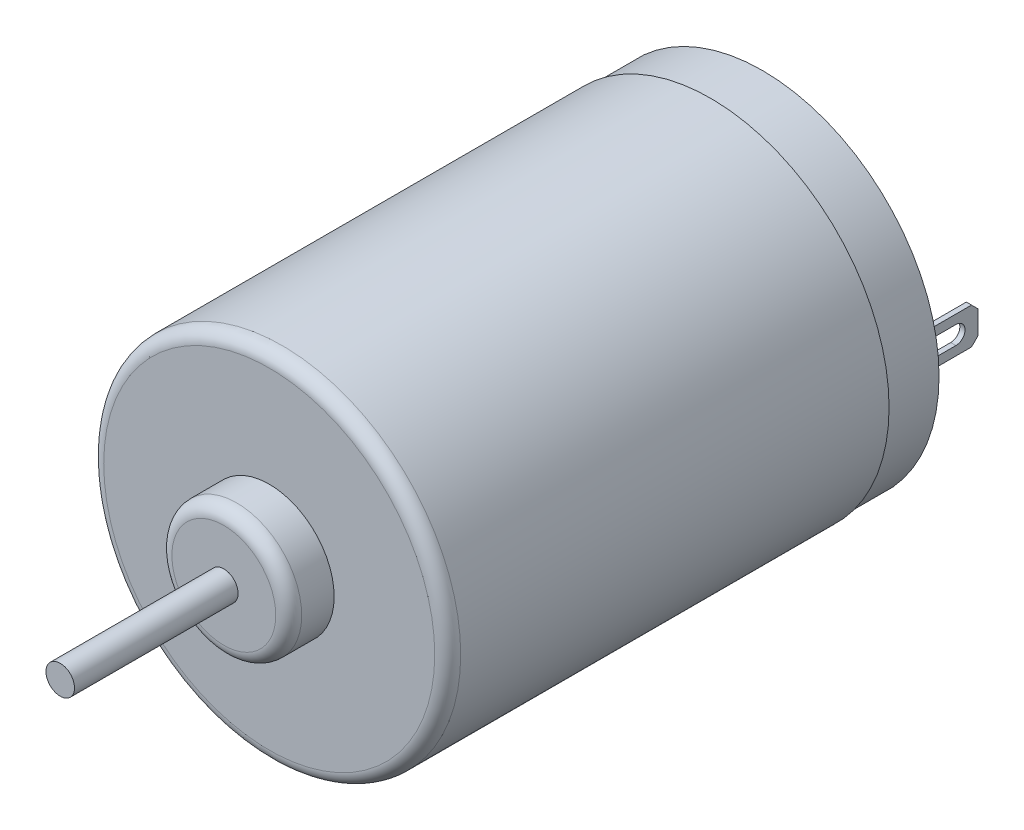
SolidWorks part; units mm, degrees
ref_plane "Plan de face" through (0, 0, 0) normal (0, 0, 1) x (1, 0, 0)
ref_plane "Plan de dessus" through (0, 0, 0) normal (0, 1, 0) x (1, 0, 0)
ref_plane "Plan de droite" through (0, 0, 0) normal (1, 0, 0) x (0, 0, -1)
sketch "Esquisse1" plane through (0, 0, 0) normal (0, 0, 1) x (1, 0, 0)
  circle A0 centre (0, 0) radius 13.75
extrude "Boss.-Extru.1" add sketch "Esquisse1" along normal blind 34
sketch "Esquisse2" plane through (0, 0, 34) normal (0, 0, 1) x (1, 0, 0)
  circle A0 centre (0, 0) radius 5
extrude "Boss.-Extru.2" add sketch "Esquisse2" along normal blind 3.5
sketch "Esquisse3" plane through (0, 0, 37.5) normal (0, 0, 1) x (1, 0, 0)
  circle A0 centre (0, 0) radius 1.1
extrude "Boss.-Extru.3" add sketch "Esquisse3" along normal blind 12.6
sketch "Esquisse4" plane through (0, 0, 0) normal (0, 0, -1) x (-1, 0, 0)
  circle A0 centre (0, 0) radius 13.6
extrude "Boss.-Extru.4" add sketch "Esquisse4" along normal blind 4
sketch "Esquisse5" plane through (0, 0, -4) normal (0, 0, -1) x (-1, 0, 0)
  circle A0 centre (0, 0) radius 10.8455
  circle A1 centre (0, 0) radius 6
extrude "Enlèv. mat.-Extru.1" cut sketch "Esquisse5" against normal blind 1
sketch "Esquisse6" plane through (0, 0, -4) normal (0, 0, -1) x (-1, 0, 0)
  circle A0 centre (0, 0) radius 5
extrude "Boss.-Extru.5" add sketch "Esquisse6" along normal blind 2.2
sketch "Esquisse7" plane through (0, 0, -6.2) normal (0, 0, -1) x (-1, 0, 0)
  circle A0 centre (0, 0) radius 1.1
extrude "Boss.-Extru.6" add sketch "Esquisse7" along normal blind 1
sketch "Esquisse8" plane through (0, 0, -4) normal (0, 0, -1) x (-1, 0, 0)
  line L0 (0, -8.3353) -> (0, 14.7684) construction
  line L1 (-11.5, 14.7684) -> (-11.5, -8.3353) construction
  line L2 (-15.391, 0) -> (2.6977, 0) construction
  line L3 (-11.1, -8.3353) -> (-11.1, 10.0301) construction
  line L4 (-17.6045, 1.4) -> (-10.2565, 1.4) construction
  line L5 (-17.6045, -1.4) -> (-10.2565, -1.4) construction
  line L7 (-11.5, 1.4) -> (-11.1, 1.4)
  line L8 (-11.5, 1.4) -> (-11.5, -1.4)
  line L9 (-11.5, -1.4) -> (-11.1, -1.4)
  line L10 (-11.1, 1.4) -> (-11.1, -1.4)
  dimension "D1" = 11.5
  dimension "D2" = 0.4
  dimension "D3" = 1.4
  dimension "D4" = 2.8
extrude "Boss.-Extru.7" add sketch "Esquisse8" along normal blind 5.1
ref_plane "Plan1" through (0, 0, 0) normal (1, 0, 0) x (0, 0, -1)
sketch "Esquisse9" plane through (11.5, 0, 0) normal (1, 0, 0) x (0, 0, -1)
  line L0 (9.9261, 0) -> (5.0041, 0) construction
  line L1 (9.4184, 0.9) -> (4.6929, 0.9) construction
  line L2 (9.1, 1.8922) -> (9.1, -1.572) construction
  line L3 (8.6, 1.8922) -> (8.6, 0.6556) construction
  line L4 (8.1, 1.7448) -> (8.1, -0.6056) construction
  line L5 (5.1, 1.7448) -> (5.1, -0.6056) construction
  line L6 (9.4184, 1.4) -> (6.6666, 1.4) construction
  line L7 (9.1, 1.4) -> (4, 1.4) construction
  line L8 (4.8239, 0.7) -> (9.9261, 0.7) construction
  line L9 (6.6, 2.056) -> (6.6, 1.0405) construction
  line L10 (7.4, -0.4828) -> (7.4, 1.3026) construction
  line L11 (5.8, 0.7) -> (7.4, 0.7)
  line L12 (8.6, 1.4) -> (9.1, 0.9)
  line L13 (9.1, 0.9) -> (9.1, 1.4)
  line L14 (9.1, 1.4) -> (8.6, 1.4)
  line L15 (9.1, -0.9) -> (9.1, -1.4)
  line L16 (9.1, -1.4) -> (8.6, -1.4)
  line L17 (8.6, -1.4) -> (9.1, -0.9)
  line L18 (5.8, -0.7) -> (7.4, -0.7)
  arc A0 (7.4, -0.7) -> (7.4, 0.7) centre (7.4, 0) ccw
  arc A1 (5.8, -0.7) -> (5.8, 0.7) centre (5.8, 0) cw
  dimension "D1" = 0.5
  dimension "D2" = 0.5
  dimension "D3" = 1
  dimension "D4" = 3
  dimension "D5" = 0.7
  dimension "D6" = 0.7
  dimension "D7" = 1.5
extrude "Enlèv. mat.-Extru.2" cut sketch "Esquisse9" against normal blind 0.5
fillet "Congé1" radius 1 2 edges at (5, 0, 37.5) (13.75, 0, 34)
mirror "Symétrie1" about plane through (0, 0, 0) normal (1, 0, 0) of "Enlèv. mat.-Extru.2", "Boss.-Extru.7"
